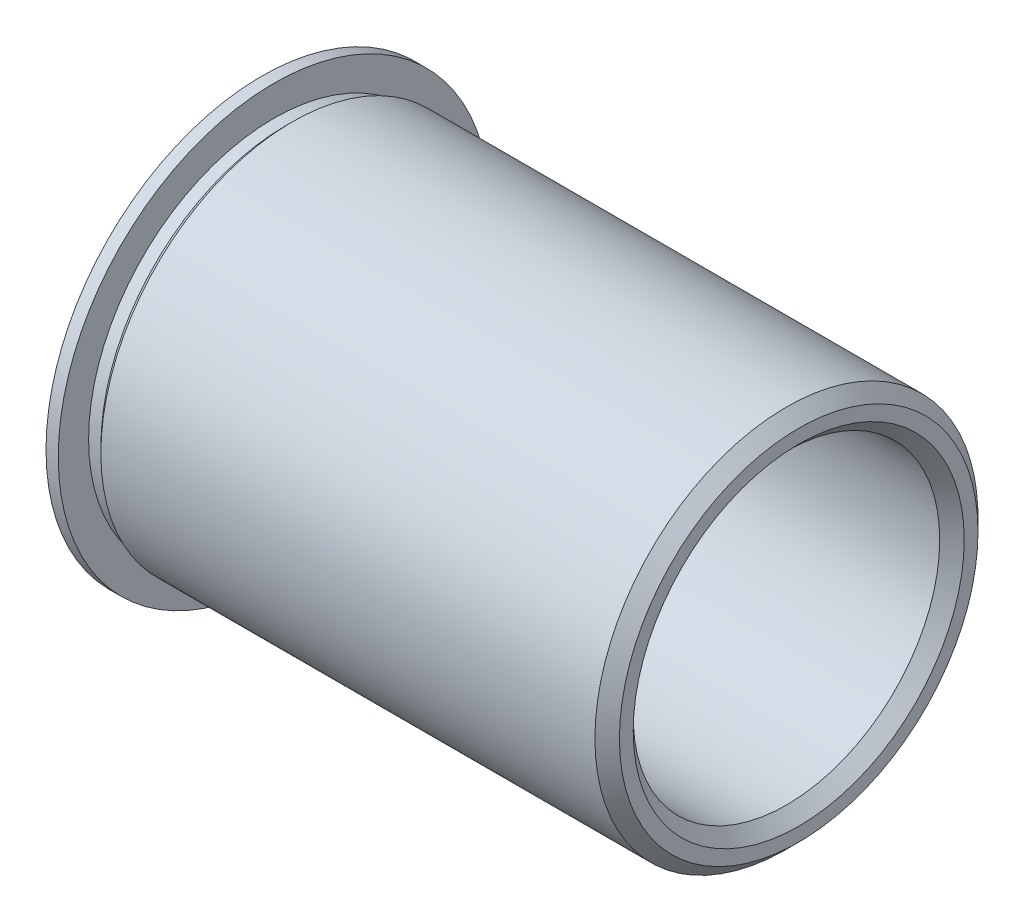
SolidWorks part; units mm, degrees
ref_plane "Front Plane" through (0, 0, 0) normal (0, 0, 1) x (1, 0, 0)
ref_plane "Top Plane" through (0, 0, 0) normal (0, 1, 0) x (1, 0, 0)
ref_plane "Right Plane" through (0, 0, 0) normal (1, 0, 0) x (0, 0, -1)
sketch "Sketch2" plane through (0, 0, 0) normal (0, 0, 1) x (1, 0, 0)
  line L0 (-56.2163, 94.6527) -> (-56.2163, 99.1231)
  line L1 (-56.2163, 99.1231) -> (-55.9623, 99.1231)
  line L2 (-56.2163, 94.6527) -> (-45.0911, 94.6527)
  line L3 (-45.0911, 94.6527) -> (-45.0911, 98.3674)
  line L4 (-45.0911, 98.3674) -> (-45.3451, 98.6214)
  line L5 (-45.3451, 98.6214) -> (-55.5813, 98.6214)
  line L6 (-55.5813, 98.6214) -> (-55.7083, 98.4944)
  line L7 (-55.7083, 98.4944) -> (-55.9623, 98.4944)
  line L8 (-55.9623, 98.4944) -> (-55.9623, 99.1231)
  dimension "D1" = 4.4704
  dimension "D2" = 0.254
  dimension "D3" = 3.9688
  dimension "D4" = 0.254
  dimension "D5" = 0.254
  dimension "D6" = 11.1252
  dimension "D7" = 0.127
  dimension "D8" = 0.254
revolve "Revolve3" add sketch "Sketch2" angle 360 about L2
sketch "Sketch3" plane through (-45.0911, 0, 0) normal (1, 0, 0) x (0, 0, -1)
  circle A0 centre (0, 94.6527) radius 3.175
  dimension "D1" = 6.35
extrude "Cut-Extrude1" cut sketch "Sketch3" against normal through all
chamfer "Chamfer2" distance 0.254 angle 45 1 edges at (-56.2163, 94.6527, -3.175)
chamfer "Chamfer3" distance 0.254 angle 45 1 edges at (-45.0911, 94.6527, -3.175)
